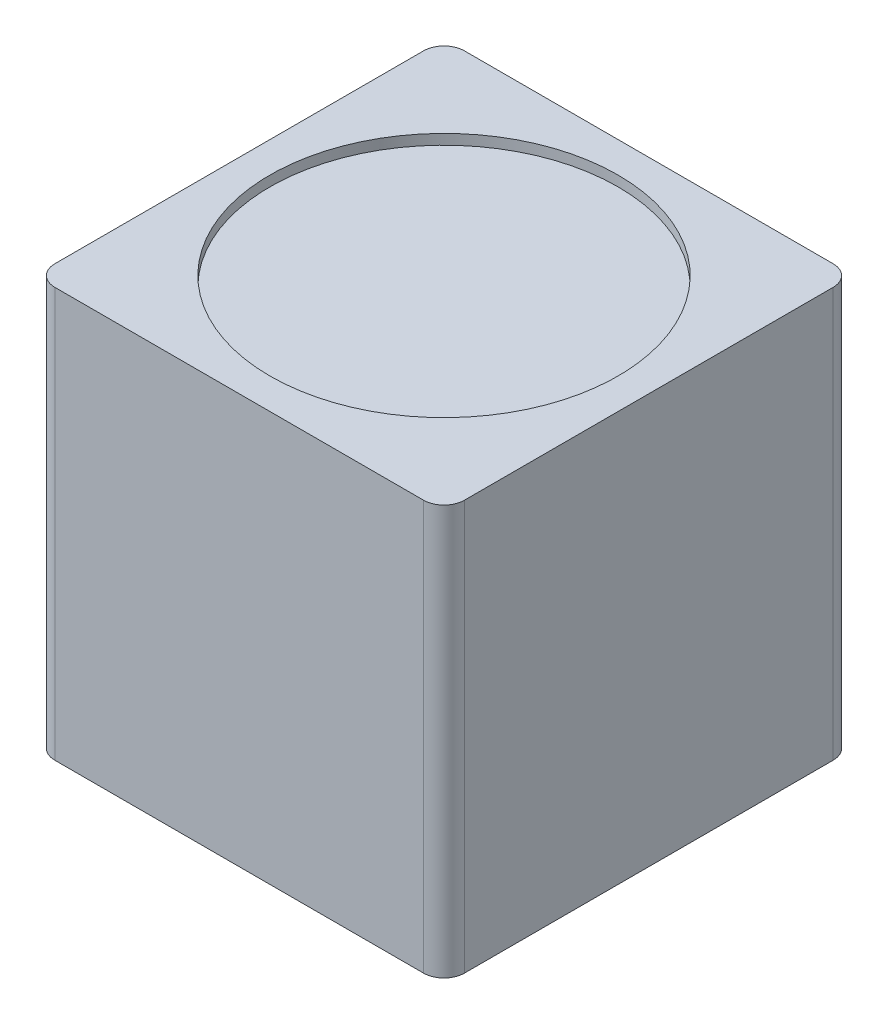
SolidWorks part; units mm, degrees
ref_plane "Front Plane" through (0, 0, 0) normal (0, 0, 1) x (1, 0, 0)
ref_plane "Top Plane" through (0, 0, 0) normal (0, 1, 0) x (1, 0, 0)
ref_plane "Right Plane" through (0, 0, 0) normal (1, 0, 0) x (0, 0, -1)
sketch "Sketch1" plane through (0, 0, 0) normal (0, 0, 1) x (1, 0, 0)
  line L0 (0, 0) -> (20, 0)
  line L1 (20, 0) -> (20, 20)
  line L2 (20, 20) -> (0, 20)
  line L3 (0, 20) -> (0, 0)
  dimension "D1" = 20
  dimension "D2" = 20
extrude "Boss-Extrude1" add sketch "Sketch1" along normal blind 20
sketch "Sketch2" plane through (0, 20, 0) normal (0, 1, 0) x (1, 0, 0)
  line L0 (10, 0) -> (10, -20) construction
  line L1 (20, 0) -> (0, 0) construction
  line L2 (20, -20) -> (0, -20) construction
  circle A0 centre (10, -10) radius 8.5
  dimension "D1" = 17
extrude "Cut-Extrude1" cut sketch "Sketch2" against normal blind 0.5 and the other way through all
fillet "Fillet1" radius 1 4 edges at (0, 10, 0) (20, 10, 0) (0, 10, 20) (20, 10, 20)
